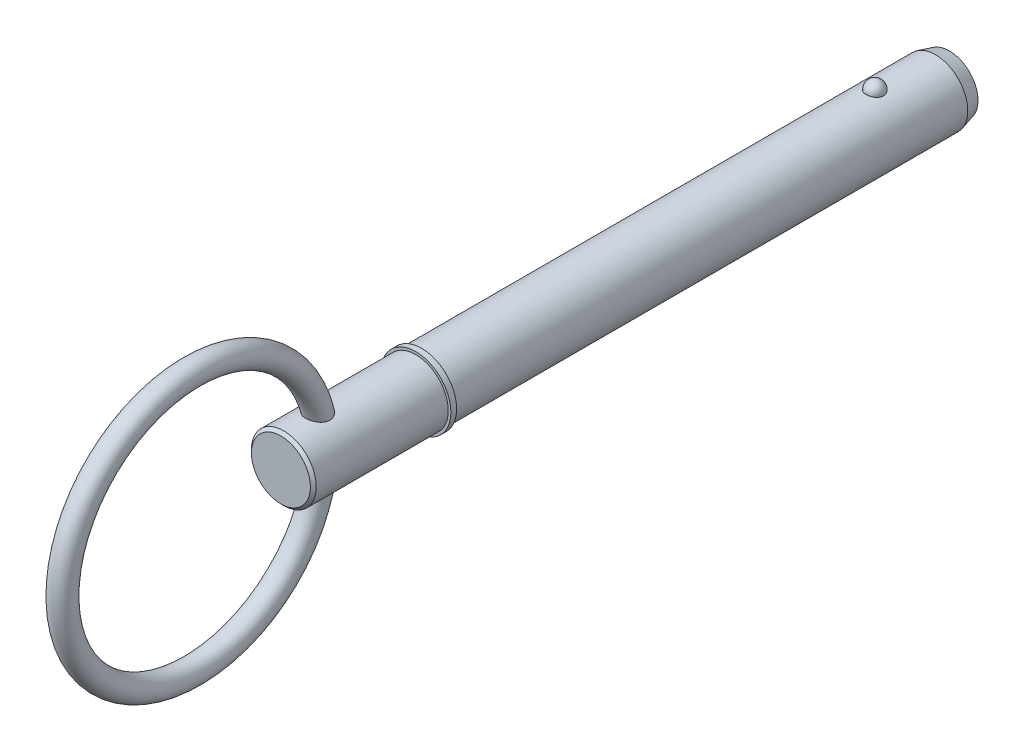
SolidWorks part; units mm, degrees
ref_plane "Front Plane" through (0, 0, 0) normal (0, 0, 1) x (1, 0, 0)
ref_plane "Top Plane" through (0, 0, 0) normal (0, 1, 0) x (1, 0, 0)
ref_plane "Right Plane" through (0, 0, 0) normal (1, 0, 0) x (0, 0, -1)
sketch "Sketch2" plane through (0, 0, 0) normal (0, 0, 1) x (1, 0, 0)
  circle A0 centre (0, 0) radius 5.555
  point P3 (0, 5.555)
  dimension "D1" = 11.11
extrude "Boss-Extrude1" add sketch "Sketch2" along normal blind 76.2
sketch "Sketch3" plane through (0, 0, 0) normal (0, 0, -1) x (-1, 0, 0)
  circle A0 centre (0, 0) radius 5.555
  dimension "D1" = 11.11
extrude "Boss-Extrude2" add sketch "Sketch3" along normal blind 14.27
chamfer "Chamfer1" distance 2.4 angle 15 1 edges at (-5.555, 0, -14.27)
sketch "Sketch18" plane through (0, 0, 0) normal (1, 0, 0) x (0, 0, -1)
  line L0 (11.87, 5.555) -> (-76.2, 5.555) construction
  line L1 (1.49, 7.045) -> (1.49, 4.065)
  line L2 (-76.2, -5.555) -> (11.87, -5.555) construction
  arc A0 (1.49, 7.045) -> (1.49, 4.065) centre (1.49, 5.555) ccw
  point P4 (0, 5.555)
  dimension "D1" = 12.6
revolve "Revolve1" add sketch "Sketch18" angle 360 about L1
sketch "Sketch19" plane through (0, 0, 0) normal (1, 0, 0) x (0, 0, -1)
  line L0 (-33.7288, 0) -> (-46.4542, 0) construction
sketch "Sketch20" plane through (0, 0, 0) normal (1, 0, 0) x (0, 0, -1)
  line L0 (-76.2, 0) -> (-76.2, 6)
  line L1 (-76.2, 5.555) -> (-76.2, -5.555) construction
  line L2 (-76.2, 6) -> (-77.2, 6)
  line L3 (-77.2, 6) -> (-77.2, 0)
  line L4 (-33.7288, 0) -> (-46.4542, 0) construction
  line L5 (-77.2, 0) -> (-76.2, 0)
  dimension "D1" = 6
  dimension "D2" = 1
revolve "Revolve2" add sketch "Sketch20" angle 360 about L0
sketch "Sketch21" plane through (0, 0, 76.2) normal (0, 0, -1) x (-1, 0, 0)
  circle A0 centre (0, 0) radius 5.555
  dimension "D1" = 11.11
extrude "Boss-Extrude3" add sketch "Sketch21" against normal blind 24.13
chamfer "Chamfer2" distance 0.5 angle 45 1 edges at (-5.555, 0, 100.33)
sketch "Sketch23" plane through (0, 0, 0) normal (1, 0, 0) x (0, 0, -1)
  line L0 (-100.33, 5.055) -> (-100.33, -5.055) construction
  circle A0 centre (-115.555, 0) radius 22.225
  point P2 (-93.33, 0)
  dimension "D1" = 44.45
  dimension "D2" = 7
sketch "Sketch24" plane through (0, 0, 0) normal (0, 1, 0) x (1, 0, 0)
  circle A0 centre (0, -93.33) radius 2
  dimension "D1" = 4
sweep "Sweep1" add profiles "Sketch24" path "Sketch23"
